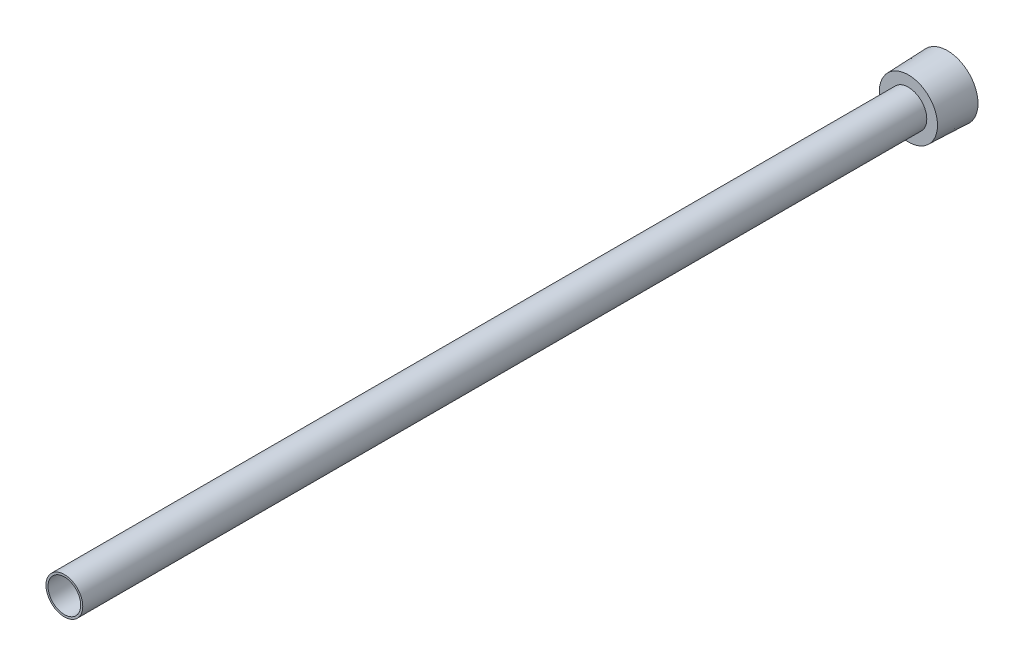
SolidWorks part; units mm, degrees
ref_plane "Front Plane" through (0, 0, 0) normal (0, 0, 1) x (1, 0, 0)
ref_plane "Top Plane" through (0, 0, 0) normal (0, 1, 0) x (1, 0, 0)
ref_plane "Right Plane" through (0, 0, 0) normal (1, 0, 0) x (0, 0, -1)
sketch "Sketch1" plane through (0, 0, 0) normal (1, 0, 0) x (0, 0, -1)
  line L0 (-223.2122, 0) -> (49776.7878, 0) construction
  line L6 (0, 10.541) -> (-13.4874, 10.049)
  line L7 (0, 0) -> (0, 10.541)
  line L8 (-13.4874, 10.049) -> (-13.4874, 6.35)
  line L9 (-13.4874, 6.35) -> (-304.8, 6.35)
  line L10 (-304.8, 6.35) -> (-304.8, 0)
  line L11 (0, 0) -> (-304.8, 0)
  dimension "D1" = 2.089
  dimension "D2" = 13.4874
  dimension "D3" = 21.082
  dimension "D4" = 12.7
  dimension "D5" = 304.8
revolve "Revolve1" add sketch "Sketch1" angle 360 about L0
sketch "Sketch2" plane through (0, 0, 304.8) normal (0, 0, 1) x (1, 0, 0)
  circle A0 centre (0, 0) radius 5.6388
  dimension "D1" = 11.2776
extrude "Cut-Extrude1" cut sketch "Sketch2" against normal through all
sketch "Sketch3" plane through (0, 0, 0) normal (0, 0, -1) x (-1, 0, 0)
  line L0 (0, 11.5951) -> (0, -11.5951) construction
  line L1 (0, -7.3323) -> (6.35, -3.6662)
  line L2 (6.35, -3.6662) -> (6.35, 3.6662)
  line L3 (6.35, 3.6662) -> (0, 7.3323)
  line L4 (0, 7.3323) -> (-6.35, 3.6662)
  line L5 (-6.35, 3.6662) -> (-6.35, -3.6662)
  line L6 (-6.35, -3.6662) -> (0, -7.3323)
  circle A0 centre (0, 0) radius 6.35 construction
  dimension "D1" = 12.7
extrude "Cut-Extrude2" cut sketch "Sketch3" against normal blind 9.525
